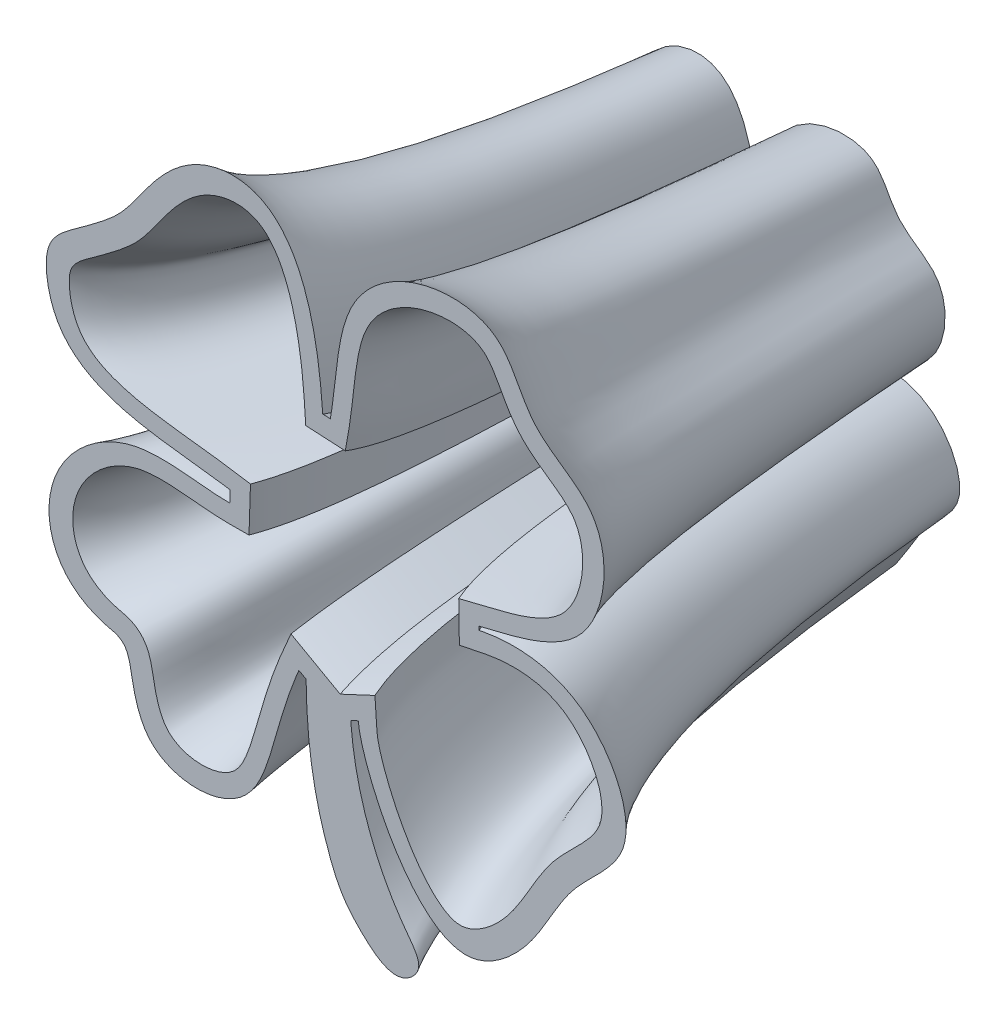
SolidWorks part; units mm, degrees
ref_plane "Front Plane" through (0, 0, 0) normal (0, 0, 1) x (1, 0, 0)
ref_plane "Top Plane" through (0, 0, 0) normal (0, 1, 0) x (1, 0, 0)
ref_plane "Right Plane" through (0, 0, 0) normal (1, 0, 0) x (0, 0, -1)
sketch "Sketch1" plane through (0, 0, 0) normal (0, 0, 1) x (1, 0, 0)
  line B0 (-6.9618, 11.8082) -> (-7.4117, 11.3809)
  line B1 (-6.5333, 12.1571) -> (-6.9618, 11.8082)
  line B2 (9.8713, -9.1728) -> (10.3931, -8.2613)
  line B3 (3.6608, -10.7079) -> (4.2131, -11.2741)
  line B4 (3.1675, -12.2563) -> (2.3114, -10.7666)
  line B5 (2.3926, -8.7472) -> (2.6395, -9.243)
  line B6 (2.1534, -8.2129) -> (2.3926, -8.7472)
  line B7 (-1.1156, -4.8062) -> (-1.0601, -4.9217)
  line B8 (-1.0601, -4.9217) -> (-1.0119, -5.2367)
  line B9 (-1.0119, -5.2367) -> (-0.9762, -5.7029)
  line B10 (-0.9762, -5.7029) -> (-0.9582, -6.2724)
  line B11 (-0.9582, -6.2724) -> (-0.8845, -7.6366)
  line B12 (-0.8845, -7.6366) -> (-0.7032, -8.948)
  line B13 (-0.7032, -8.948) -> (-0.4234, -10.1831)
  line B14 (-0.4234, -10.1831) -> (-0.0538, -11.3182)
  line B15 (-0.0538, -11.3182) -> (0.3965, -12.3303)
  line B16 (0.3965, -12.3303) -> (0.9185, -13.1955)
  line B17 (0.9185, -13.1955) -> (1.5034, -13.8908)
  line B18 (1.5034, -13.8908) -> (2.1425, -14.3928)
  line B19 (2.1425, -14.3928) -> (2.686, -14.6676)
  line B20 (2.686, -14.6676) -> (3.1317, -14.772)
  line B21 (3.1317, -14.772) -> (3.5061, -14.707)
  line B22 (3.5061, -14.707) -> (3.8363, -14.4741)
  line B23 (3.8363, -14.4741) -> (4.0016, -14.2874)
  line B24 (4.0016, -14.2874) -> (4.0693, -14.1243)
  line B25 (4.0693, -14.1243) -> (4.0463, -13.9278)
  line B26 (4.0463, -13.9278) -> (3.9394, -13.6418)
  line B27 (3.9394, -13.6418) -> (3.8119, -13.3735)
  line B28 (3.8119, -13.3735) -> (3.6238, -13.0228)
  line B29 (3.6238, -13.0228) -> (3.4006, -12.6352)
  line B30 (3.4006, -12.6352) -> (3.1675, -12.2563)
  line B31 (2.3114, -10.7666) -> (1.671, -9.3155)
  line B32 (1.671, -9.3155) -> (1.2447, -7.8981)
  line B33 (1.2447, -7.8981) -> (1.031, -6.5102)
  line B34 (1.031, -6.5102) -> (1.0052, -6.0279)
  line B35 (1.0052, -6.0279) -> (1.0097, -5.6604)
  line B36 (1.0097, -5.6604) -> (1.0406, -5.4115)
  line B37 (1.0406, -5.4115) -> (1.0938, -5.2857)
  line B38 (1.0938, -5.2857) -> (1.165, -5.2869)
  line B39 (1.165, -5.2869) -> (1.2503, -5.4192)
  line B40 (1.2503, -5.4192) -> (1.3453, -5.6867)
  line B41 (1.3453, -5.6867) -> (1.4463, -6.0937)
  line B42 (1.4463, -6.0937) -> (1.5686, -6.5805)
  line B43 (1.5686, -6.5805) -> (1.733, -7.1095)
  line B44 (1.733, -7.1095) -> (1.9308, -7.6603)
  line B45 (1.9308, -7.6603) -> (2.1534, -8.2129)
  line B46 (2.6395, -9.243) -> (2.8858, -9.6803)
  line B47 (2.8858, -9.6803) -> (3.123, -10.0391)
  line B48 (3.123, -10.0391) -> (3.6608, -10.7079)
  line B49 (4.2131, -11.2741) -> (4.7694, -11.7322)
  line B50 (4.7694, -11.7322) -> (5.3194, -12.0767)
  line B51 (5.3194, -12.0767) -> (5.8531, -12.3021)
  line B52 (5.8531, -12.3021) -> (6.3598, -12.4033)
  line B53 (6.3598, -12.4033) -> (6.8297, -12.3747)
  line B54 (6.8297, -12.3747) -> (7.2524, -12.2112)
  line B55 (7.2524, -12.2112) -> (7.6597, -11.9542)
  line B56 (7.6597, -11.9542) -> (8.0216, -11.6814)
  line B57 (8.0216, -11.6814) -> (8.359, -11.3666)
  line B58 (8.359, -11.3666) -> (8.6919, -10.9843)
  line B59 (8.6919, -10.9843) -> (9.0413, -10.5083)
  line B60 (9.0413, -10.5083) -> (9.4275, -9.9132)
  line B61 (9.4275, -9.9132) -> (9.8713, -9.1728)
  line B62 (10.3931, -8.2613) -> (10.6253, -7.9182)
  line B63 (10.6253, -7.9182) -> (10.947, -7.5347)
  line B64 (10.947, -7.5347) -> (11.3153, -7.1579)
  line B65 (11.3153, -7.1579) -> (11.6881, -6.8346)
  line B66 (11.6881, -6.8346) -> (12.4301, -6.1425)
  line B67 (12.4301, -6.1425) -> (12.9461, -5.3904)
  line B68 (12.9461, -5.3904) -> (13.2467, -4.5583)
  line B69 (13.2467, -4.5583) -> (13.3421, -3.6258)
  line B70 (13.3421, -3.6258) -> (13.2898, -2.9612)
  line B71 (13.2898, -2.9612) -> (13.1392, -2.3385)
  line B72 (13.1392, -2.3385) -> (12.8927, -1.7603)
  line B73 (12.8927, -1.7603) -> (12.5528, -1.2298)
  line B74 (12.5528, -1.2298) -> (12.121, -0.7496)
  line B75 (12.121, -0.7496) -> (11.6001, -0.3228)
  line B76 (11.6001, -0.3228) -> (10.9924, 0.0475)
  line B77 (10.9924, 0.0475) -> (10.2998, 0.3585)
  line B78 (10.2998, 0.3585) -> (9.9551, 0.4873)
  line B79 (9.9551, 0.4873) -> (9.6671, 0.5838)
  line B80 (9.6671, 0.5838) -> (9.412, 0.6507)
  line B81 (9.412, 0.6507) -> (9.1661, 0.6906)
  line B82 (9.1661, 0.6906) -> (8.9061, 0.7064)
  line B83 (8.9061, 0.7064) -> (8.6084, 0.7004)
  line B84 (8.6084, 0.7004) -> (8.2491, 0.6754)
  line B85 (8.2491, 0.6754) -> (7.805, 0.6339)
  line B86 (7.805, 0.6339) -> (7.3205, 0.5932)
  line B87 (7.3205, 0.5932) -> (6.9368, 0.5741)
  line B88 (6.9368, 0.5741) -> (6.6614, 0.5751)
  line B89 (6.6614, 0.5751) -> (6.502, 0.5938)
  line B90 (6.502, 0.5938) -> (6.4662, 0.6282)
  line B91 (6.4662, 0.6282) -> (6.5614, 0.6765)
  line B92 (6.5614, 0.6765) -> (6.7959, 0.7361)
  line B93 (6.7959, 0.7361) -> (7.177, 0.805)
  line B94 (7.177, 0.805) -> (7.6934, 0.9127)
  line B95 (7.6934, 0.9127) -> (8.2428, 1.0717)
  line B96 (8.2428, 1.0717) -> (8.8064, 1.2735)
  line B97 (8.8064, 1.2735) -> (9.3653, 1.5098)
  line B98 (9.3653, 1.5098) -> (9.9004, 1.7716)
  line B99 (9.9004, 1.7716) -> (10.3928, 2.0503)
  line B100 (10.3928, 2.0503) -> (10.8235, 2.3376)
  line B101 (10.8235, 2.3376) -> (11.1739, 2.6246)
  line B102 (11.1739, 2.6246) -> (11.5667, 3.012)
  line B103 (11.5667, 3.012) -> (11.8838, 3.3731)
  line B104 (11.8838, 3.3731) -> (12.1307, 3.7205)
  line B105 (12.1307, 3.7205) -> (12.3125, 4.0674)
  line B106 (12.3125, 4.0674) -> (12.4352, 4.4259)
  line B107 (12.4352, 4.4259) -> (12.5039, 4.8094)
  line B108 (12.5039, 4.8094) -> (12.5244, 5.2301)
  line B109 (12.5244, 5.2301) -> (12.5021, 5.7008)
  line B110 (12.5021, 5.7008) -> (12.4311, 6.2865)
  line B111 (12.4311, 6.2865) -> (12.3144, 6.7961)
  line B112 (12.3144, 6.7961) -> (12.1376, 7.2493)
  line B113 (12.1376, 7.2493) -> (11.8872, 7.6655)
  line B114 (11.8872, 7.6655) -> (11.5483, 8.0639)
  line B115 (11.5483, 8.0639) -> (11.1077, 8.4641)
  line B116 (11.1077, 8.4641) -> (10.5506, 8.8858)
  line B117 (10.5506, 8.8858) -> (9.8636, 9.3482)
  line B118 (9.8636, 9.3482) -> (9.5868, 9.5781)
  line B119 (9.5868, 9.5781) -> (9.2838, 9.9215)
  line B120 (9.2838, 9.9215) -> (8.9673, 10.3627)
  line B121 (8.9673, 10.3627) -> (8.6498, 10.8853)
  line B122 (8.6498, 10.8853) -> (8.359, 11.3724)
  line B123 (8.359, 11.3724) -> (8.0588, 11.8246)
  line B124 (8.0588, 11.8246) -> (7.7846, 12.1916)
  line B125 (7.7846, 12.1916) -> (7.5717, 12.4227)
  line B126 (7.5717, 12.4227) -> (6.966, 12.8087)
  line B127 (6.966, 12.8087) -> (6.2679, 13.0223)
  line B128 (6.2679, 13.0223) -> (5.5015, 13.0693)
  line B129 (5.5015, 13.0693) -> (4.6916, 12.9555)
  line B130 (4.6916, 12.9555) -> (3.8626, 12.6865)
  line B131 (3.8626, 12.6865) -> (3.0392, 12.2681)
  line B132 (3.0392, 12.2681) -> (2.2458, 11.7061)
  line B133 (2.2458, 11.7061) -> (1.5072, 11.006)
  line B134 (1.5072, 11.006) -> (1.2371, 10.6828)
  line B135 (1.2371, 10.6828) -> (1.0056, 10.3406)
  line B136 (1.0056, 10.3406) -> (0.8099, 9.9711)
  line B137 (0.8099, 9.9711) -> (0.6469, 9.5664)
  line B138 (0.6469, 9.5664) -> (0.514, 9.1179)
  line B139 (0.514, 9.1179) -> (0.4083, 8.6179)
  line B140 (0.4083, 8.6179) -> (0.3268, 8.058)
  line B141 (0.3268, 8.058) -> (0.267, 7.4299)
  line B142 (0.267, 7.4299) -> (0.1712, 6.288)
  line B143 (0.1712, 6.288) -> (0.0819, 5.4834)
  line B144 (0.0819, 5.4834) -> (0, 5.0234)
  line B145 (0, 5.0234) -> (-0.0736, 4.9145)
  line B146 (-0.0736, 4.9145) -> (-0.1225, 5.0968)
  line B147 (-0.1225, 5.0968) -> (-0.1959, 5.5335)
  line B148 (-0.1959, 5.5335) -> (-0.2841, 6.1593)
  line B149 (-0.2841, 6.1593) -> (-0.3768, 6.9088)
  line B150 (-0.3768, 6.9088) -> (-0.5687, 8.1691)
  line B151 (-0.5687, 8.1691) -> (-0.8333, 9.276)
  line B152 (-0.8333, 9.276) -> (-1.1713, 10.231)
  line B153 (-1.1713, 10.231) -> (-1.5836, 11.0352)
  line B154 (-1.5836, 11.0352) -> (-2.0706, 11.6899)
  line B155 (-2.0706, 11.6899) -> (-2.6337, 12.1963)
  line B156 (-2.6337, 12.1963) -> (-3.273, 12.5557)
  line B157 (-3.273, 12.5557) -> (-3.9896, 12.7693)
  line B158 (-3.9896, 12.7693) -> (-4.4477, 12.8284)
  line B159 (-4.4477, 12.8284) -> (-4.882, 12.827)
  line B160 (-4.882, 12.827) -> (-5.3003, 12.7622)
  line B161 (-5.3003, 12.7622) -> (-5.71, 12.6312)
  line B162 (-5.71, 12.6312) -> (-6.1185, 12.4303)
  line B163 (-6.1185, 12.4303) -> (-6.5333, 12.1571)
  line B164 (-7.4117, 11.3809) -> (-7.8619, 10.8958)
  line B165 (-7.8619, 10.8958) -> (-8.3196, 10.3499)
  line B166 (-8.3196, 10.3499) -> (-8.7316, 9.8103)
  line B167 (-8.7316, 9.8103) -> (-9.0439, 9.3435)
  line B168 (-9.0439, 9.3435) -> (-9.2488, 9.0162)
  line B169 (-9.2488, 9.0162) -> (-9.4483, 8.7364)
  line B170 (-9.4483, 8.7364) -> (-9.6642, 8.486)
  line B171 (-9.6642, 8.486) -> (-9.9182, 8.246)
  line B172 (-9.9182, 8.246) -> (-10.2323, 7.9976)
  line B173 (-10.2323, 7.9976) -> (-10.6282, 7.7221)
  line B174 (-10.6282, 7.7221) -> (-11.1278, 7.4009)
  line B175 (-11.1278, 7.4009) -> (-11.7527, 7.015)
  line B176 (-11.7527, 7.015) -> (-11.9517, 6.8605)
  line B177 (-11.9517, 6.8605) -> (-12.1429, 6.6495)
  line B178 (-12.1429, 6.6495) -> (-12.3205, 6.3941)
  line B179 (-12.3205, 6.3941) -> (-12.4787, 6.1057)
  line B180 (-12.4787, 6.1057) -> (-12.612, 5.7959)
  line B181 (-12.612, 5.7959) -> (-12.7148, 5.4766)
  line B182 (-12.7148, 5.4766) -> (-12.7813, 5.159)
  line B183 (-12.7813, 5.159) -> (-12.8059, 4.8549)
  line B184 (-12.8059, 4.8549) -> (-12.7782, 4.572)
  line B185 (-12.7782, 4.572) -> (-12.6967, 4.2408)
  line B186 (-12.6967, 4.2408) -> (-12.5699, 3.8782)
  line B187 (-12.5699, 3.8782) -> (-12.4057, 3.5014)
  line B188 (-12.4057, 3.5014) -> (-12.2122, 3.127)
  line B189 (-12.2122, 3.127) -> (-11.9974, 2.7719)
  line B190 (-11.9974, 2.7719) -> (-11.7694, 2.4533)
  line B191 (-11.7694, 2.4533) -> (-11.5362, 2.188)
  line B192 (-11.5362, 2.188) -> (-11.2393, 1.9503)
  line B193 (-11.2393, 1.9503) -> (-10.8288, 1.7476)
  line B194 (-10.8288, 1.7476) -> (-10.2313, 1.5505)
  line B195 (-10.2313, 1.5505) -> (-9.3729, 1.33)
  line B196 (-9.3729, 1.33) -> (-8.6068, 1.1576)
  line B197 (-8.6068, 1.1576) -> (-7.7891, 0.9904)
  line B198 (-7.7891, 0.9904) -> (-7.0174, 0.8479)
  line B199 (-7.0174, 0.8479) -> (-6.3896, 0.7487)
  line B200 (-6.3896, 0.7487) -> (-5.6777, 0.6511)
  line B201 (-5.6777, 0.6511) -> (-5.1294, 0.5716)
  line B202 (-5.1294, 0.5716) -> (-4.7237, 0.5054)
  line B203 (-4.7237, 0.5054) -> (-4.4394, 0.4471)
  line B204 (-4.4394, 0.4471) -> (-4.2552, 0.3918)
  line B205 (-4.2552, 0.3918) -> (-4.1499, 0.3341)
  line B206 (-4.1499, 0.3341) -> (-4.1022, 0.2692)
  line B207 (-4.1022, 0.2692) -> (-4.091, 0.1916)
  line B208 (-4.091, 0.1916) -> (-4.1097, 0.0886)
  line B209 (-4.1097, 0.0886) -> (-4.1713, 0.0099)
  line B210 (-4.1713, 0.0099) -> (-4.2843, -0.0455)
  line B211 (-4.2843, -0.0455) -> (-4.457, -0.0785)
  line B212 (-4.457, -0.0785) -> (-4.6979, -0.0899)
  line B213 (-4.6979, -0.0899) -> (-5.0155, -0.0809)
  line B214 (-5.0155, -0.0809) -> (-5.4181, -0.0519)
  line B215 (-5.4181, -0.0519) -> (-5.914, -0.0045)
  line B216 (-5.914, -0.0045) -> (-6.515, 0.0439)
  line B217 (-6.515, 0.0439) -> (-7.1194, 0.066)
  line B218 (-7.1194, 0.066) -> (-7.7149, 0.0627)
  line B219 (-7.7149, 0.0627) -> (-8.2883, 0.0347)
  line B220 (-8.2883, 0.0347) -> (-8.8271, -0.0169)
  line B221 (-8.8271, -0.0169) -> (-9.3185, -0.0911)
  line B222 (-9.3185, -0.0911) -> (-9.7496, -0.1872)
  line B223 (-9.7496, -0.1872) -> (-10.1077, -0.3041)
  line B224 (-10.1077, -0.3041) -> (-10.5491, -0.5386)
  line B225 (-10.5491, -0.5386) -> (-10.9759, -0.875)
  line B226 (-10.9759, -0.875) -> (-11.3767, -1.2965)
  line B227 (-11.3767, -1.2965) -> (-11.7407, -1.7859)
  line B228 (-11.7407, -1.7859) -> (-12.0567, -2.3267)
  line B229 (-12.0567, -2.3267) -> (-12.3134, -2.9019)
  line B230 (-12.3134, -2.9019) -> (-12.4998, -3.4947)
  line B231 (-12.4998, -3.4947) -> (-12.6049, -4.0884)
  line B232 (-12.6049, -4.0884) -> (-12.6126, -4.6721)
  line B233 (-12.6126, -4.6721) -> (-12.5199, -5.2401)
  line B234 (-12.5199, -5.2401) -> (-12.3358, -5.7789)
  line B235 (-12.3358, -5.7789) -> (-12.0693, -6.2746)
  line B236 (-12.0693, -6.2746) -> (-11.7291, -6.7138)
  line B237 (-11.7291, -6.7138) -> (-11.3239, -7.0829)
  line B238 (-11.3239, -7.0829) -> (-10.8627, -7.3685)
  line B239 (-10.8627, -7.3685) -> (-10.3542, -7.5568)
  line B240 (-10.3542, -7.5568) -> (-9.6049, -7.7478)
  line B241 (-9.6049, -7.7478) -> (-9.2157, -8.9824)
  line B242 (-9.2157, -8.9824) -> (-8.947, -9.6864)
  line B243 (-8.947, -9.6864) -> (-8.6129, -10.3173)
  line B244 (-8.6129, -10.3173) -> (-8.2235, -10.8658)
  line B245 (-8.2235, -10.8658) -> (-7.7891, -11.3227)
  line B246 (-7.7891, -11.3227) -> (-7.32, -11.6787)
  line B247 (-7.32, -11.6787) -> (-6.826, -11.9249)
  line B248 (-6.826, -11.9249) -> (-6.3177, -12.0517)
  line B249 (-6.3177, -12.0517) -> (-5.8049, -12.0505)
  line B250 (-5.8049, -12.0505) -> (-5.2319, -11.9088)
  line B251 (-5.2319, -11.9088) -> (-4.5967, -11.6503)
  line B252 (-4.5967, -11.6503) -> (-3.9924, -11.319)
  line B253 (-3.9924, -11.319) -> (-3.5106, -10.9591)
  line B254 (-3.5106, -10.9591) -> (-3.3803, -10.7908)
  line B255 (-3.3803, -10.7908) -> (-3.2327, -10.5164)
  line B256 (-3.2327, -10.5164) -> (-3.0714, -10.1468)
  line B257 (-3.0714, -10.1468) -> (-2.9008, -9.6935)
  line B258 (-2.9008, -9.6935) -> (-2.7246, -9.1671)
  line B259 (-2.7246, -9.1671) -> (-2.5466, -8.5793)
  line B260 (-2.5466, -8.5793) -> (-2.3712, -7.9409)
  line B261 (-2.3712, -7.9409) -> (-2.2019, -7.263)
  line B262 (-2.2019, -7.263) -> (-2.0984, -6.8841)
  line B263 (-2.0984, -6.8841) -> (-1.9643, -6.4774)
  line B264 (-1.9643, -6.4774) -> (-1.8104, -6.0671)
  line B265 (-1.8104, -6.0671) -> (-1.6472, -5.6775)
  line B266 (-1.6472, -5.6775) -> (-1.4855, -5.3324)
  line B267 (-1.4855, -5.3324) -> (-1.3359, -5.056)
  line B268 (-1.3359, -5.056) -> (-1.2091, -4.8725)
  line B269 (-1.2091, -4.8725) -> (-1.1156, -4.8062)
sketch_block_instance "shamrock-line-makerbot-1"
sketch_block "shamrock-line-makerbot"
ref_plane "Plane1" through (0, 0, 38.1) normal (0, 0, 1) x (1, 0, 0)
sketch "Sketch4" plane through (0, 0, 0) normal (0, 0, 1) x (1, 0, 0)
  line L3 (8.8347, 0.9569) -> (8.8389, 0.7469)
  line L30 (1.7489, -7.3928) -> (1.3096, -7.5974)
  line L31 (-1.7367, -6.5727) -> (-1.3154, -6.8077)
  line L32 (0.1065, 7.1284) -> (-0.3387, 7.1527)
  line L33 (-5.7713, 0.5812) -> (-5.7941, -0.1021)
  spline S0 degree 3 poles (-5.7713, 0.5812) (-9.6726, 1.2004) (-15.8254, 1.0376) (-16.9381, 8.4909) (-14.8632, 9.0371) (-11.2192, 12.2582) (-9.0471, 16.4735) (-3.5685, 16.7961) (-0.8156, 14.2242) (-0.3387, 7.1527) knots 0 0 0 0 0.449056 0.55428 0.772887 0.810219 0.914562 0.934844 1 1 1 1
  spline S1 degree 3 poles (0.1065, 7.1284) (0.5388, 9.5568) (0.3755, 13.5496) (4.9785, 17.0982) (10.3555, 17.0072) (11.7215, 12.233) (16.7975, 10.3659) (15.9891, 2.3801) (11.0076, 1.5093) (8.8347, 0.9569) knots 0 0 0 0 0.185102 0.301269 0.433184 0.533123 0.652845 0.817186 1 1 1 1
  spline S2 degree 3 poles (8.8389, 0.7469) (10.9648, 1.1819) (15.4696, 0.885) (18.7533, -6.0447) (13.8073, -9.5543) (12.2931, -13.6999) (5.9274, -18.8617) (1.8783, -9.4027) (1.7489, -7.3928) knots 0 0 0 0 0.173157 0.333322 0.45393 0.595196 0.699107 1 1 1 1
  spline S3 degree 3 poles (1.3096, -7.5974) (1.481, -10.1951) (2.5022, -14.3029) (5.7346, -18.1257) (3.9086, -19.7997) (1.2287, -17.5207) (0.1179, -15.7788) (-1.2742, -10.7194) (-1.3154, -6.8077) knots 0 0 0 0 0.423346 0.498399 0.556999 0.671332 0.851614 1 1 1 1
  spline S4 degree 3 poles (-5.7941, -0.1021) (-7.5583, -0.1142) (-11.9161, 1.0266) (-17.4576, -3.8809) (-16.0154, -8.9573) (-13.0696, -9.9382) (-11.4, -10.2706) (-11.8172, -11.93) (-10.0611, -15.7004) (-6.4312, -15.9929) (-3.3579, -13.0593) (-3.1052, -9.7636) (-1.7367, -6.5727) knots 0 0 0 0 0.199534 0.430455 0.630221 0.653755 0.665787 0.761687 0.784406 0.880921 0.903687 1 1 1 1
sketch "Sketch5" plane through (0, 0, 38.1) normal (0, 0, 1) x (1, 0, 0)
  line L5 (-2.6051, -9.8591) -> (-1.9731, -10.2116)
  line L6 (2.6234, -11.0892) -> (1.9645, -11.3961)
  line L7 (13.252, 1.4354) -> (13.2583, 1.1204)
  line L8 (0.1597, 10.6927) -> (-0.5081, 10.729)
  line L9 (-8.6569, 0.8718) -> (-8.6912, -0.1531)
  spline S5 degree 3 poles (1.9645, -11.3961) (2.2215, -15.2927) (3.7532, -21.4543) (8.6019, -27.1885) (5.8629, -29.6995) (1.843, -26.2811) (0.1768, -23.6682) (-1.9113, -16.0791) (-1.9731, -10.2116) knots 0 0 0 0 0.423346 0.498399 0.556999 0.671332 0.851614 1 1 1 1
  spline S6 degree 3 poles (13.2583, 1.1204) (16.4472, 1.7729) (23.2044, 1.3275) (28.1299, -9.0671) (20.711, -14.3315) (18.4396, -20.5499) (8.891, -28.2925) (2.8175, -14.1041) (2.6234, -11.0892) knots 0 0 0 0 0.173157 0.333322 0.45393 0.595196 0.699107 1 1 1 1
  spline S7 degree 3 poles (0.1597, 10.6927) (0.8082, 14.3352) (0.5632, 20.3244) (7.4677, 25.6472) (15.5333, 25.5107) (17.5822, 18.3495) (25.1962, 15.5488) (23.9837, 3.5702) (16.5114, 2.2639) (13.252, 1.4354) knots 0 0 0 0 0.185102 0.301269 0.433184 0.533123 0.652845 0.817186 1 1 1 1
  spline S8 degree 3 poles (-8.6569, 0.8718) (-14.5089, 1.8006) (-23.7381, 1.5564) (-25.4071, 12.7364) (-22.2947, 13.5557) (-16.8287, 18.3873) (-13.5706, 24.7103) (-5.3527, 25.1941) (-1.2234, 21.3364) (-0.5081, 10.729) knots 0 0 0 0 0.449056 0.55428 0.772887 0.810219 0.914562 0.934844 1 1 1 1
  spline S9 degree 3 poles (-8.6912, -0.1531) (-11.3375, -0.1713) (-17.8741, 1.5398) (-26.1864, -5.8213) (-24.0231, -13.4359) (-19.6044, -14.9073) (-17.1, -15.4059) (-17.7257, -17.8951) (-15.0916, -23.5507) (-9.6468, -23.9894) (-5.0369, -19.589) (-4.6578, -14.6454) (-2.6051, -9.8591) knots 0 0 0 0 0.199534 0.430455 0.630221 0.653755 0.665787 0.761687 0.784406 0.880921 0.903687 1 1 1 1
  point P0 (0, 0)
ref_plane "Plane2" through (0, 0, 0) normal (-0.5508, -0.8346, 0) x (0.8346, -0.5508, 0)
sketch "Sketch6" plane through (0, 0, 0) normal (-0.5508, -0.8346, 0) x (0.8346, -0.5508, 0)
  line L0 (21.9148, 38.1) -> (-21.9148, 38.1) construction
  line L1 (26.8255, 38.1) -> (8.2978, 38.1) construction
  line L2 (17.8836, 0) -> (5.5318, 0) construction
  spline S0 degree 2 poles (26.0067, 38.1) (19.5748, 32.3332) (17.3378, 0) knots 0 0 0 1 1 1
ref_plane "Plane3" through (0, 0, 0) normal (-0.7302, 0.6833, 0) x (0, 0, 1)
sketch "Sketch7" plane through (0, 0, 0) normal (-0.7302, 0.6833, 0) x (0, 0, 1)
  line L0 (0, 5.2778) -> (0, 18.5034) construction
  line L1 (38.1, 7.9167) -> (38.1, 27.7551) construction
  spline S0 degree 2 poles (0, 17.664) (30.8791, 21.0917) (38.1, 26.4961) knots 0 0 0 1 1 1
ref_plane "Plane4" through (0, 0, 0) normal (0.6789, 0.7342, 0) x (-0.7342, 0.6789, 0)
sketch "Sketch8" plane through (0, 0, 0) normal (0.6789, 0.7342, 0) x (-0.7342, 0.6789, 0)
  line L0 (26.1115, 38.1) -> (6.948, 38.1) construction
  line L1 (17.4076, 0) -> (4.632, 0) construction
  spline S0 degree 2 poles (25.0933, 38.1) (19.1088, 31.8923) (16.7288, 0) knots 0 0 0 1 1 1
ref_plane "Plane5" through (0, 0, 0) normal (0.6085, -0.7936, 0) x (0.7936, 0.6085, 0)
sketch "Sketch9" plane through (0, 0, 0) normal (0.6085, -0.7936, 0) x (0.7936, 0.6085, 0)
  line L0 (-6.9901, 38.1) -> (-26.1225, 38.1) construction
  line L1 (-4.6601, 0) -> (-17.415, 0) construction
  spline S0 degree 2 poles (-24.5227, 38.1) (-18.3988, 32.4713) (-16.3485, 0) knots 0 0 0 1 1 1
loft "Loft2" add profiles "Sketch4", "Sketch5"
shell "Shell4" thickness 1.6
